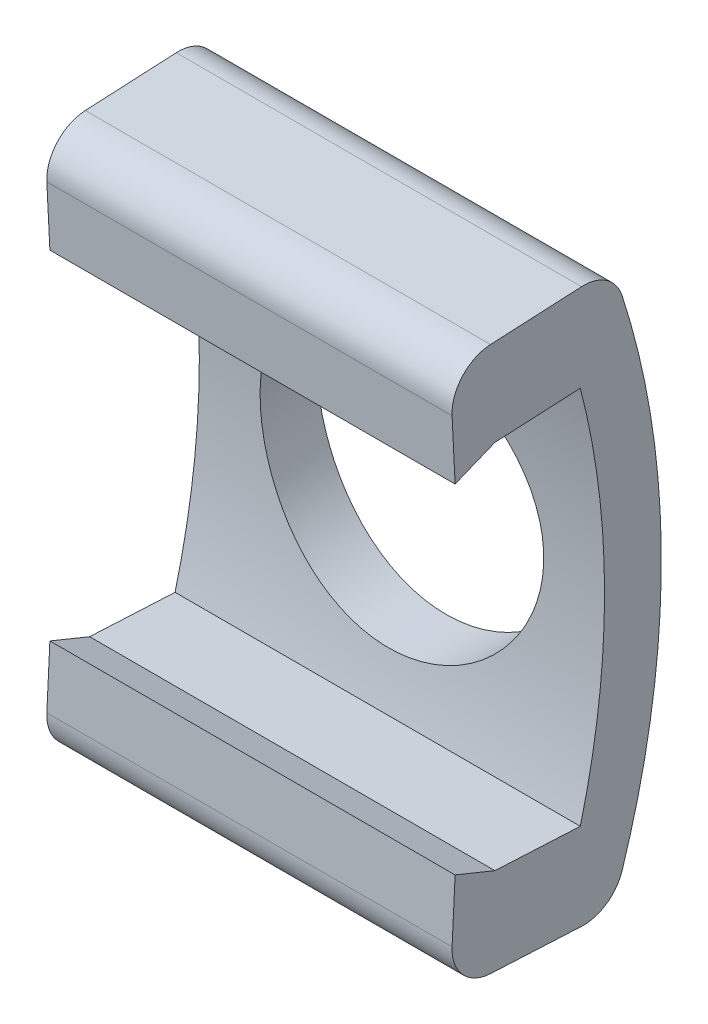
SolidWorks part; units mm, degrees
ref_plane "正面" through (0, 0, 0) normal (0, 0, 1) x (1, 0, 0)
ref_plane "平面" through (0, 0, 0) normal (0, 1, 0) x (1, 0, 0)
ref_plane "右側面" through (0, 0, 0) normal (1, 0, 0) x (0, 0, -1)
sketch "ｽｹｯﾁ1" plane through (0, 0, 0) normal (1, 0, 0) x (0, 0, -1)
  line L18 (-5.0877, -4.1759) -> (-5.1629, -5.674)
  line L19 (-4.1065, -4.5756) -> (-5.0877, -4.1759)
  line L20 (-1.9987, -4.6813) -> (-4.1065, -4.5756)
  line L21 (-1.9688, -6.8355) -> (-4.2142, -6.7229)
  line L22 (-1.9688, 6.8355) -> (-4.2142, 6.7229)
  line L23 (-5.0877, 4.1759) -> (-5.1629, 5.674)
  line L24 (-4.1065, 4.5756) -> (-5.0877, 4.1759)
  line L25 (-1.9987, 4.6813) -> (-4.1065, 4.5756)
  arc A10 (0, 0) -> (-0.9671, 6.1439) centre (-20, 0) ccw
  arc A11 (-0.9671, -6.1439) -> (0, 0) centre (-20, 0) ccw
  arc A12 (-1.4, 0) -> (-1.9987, 4.6813) centre (-20, 0) ccw
  arc A13 (-1.9987, -4.6813) -> (-1.4, 0) centre (-20, 0) ccw
  arc A14 (-1.9688, -6.8355) -> (-0.9671, -6.1439) centre (-1.9187, -5.8367) ccw
  arc A15 (-5.1629, -5.674) -> (-4.2142, -6.7229) centre (-4.1641, -5.7241) ccw
  arc A16 (-0.9671, 6.1439) -> (-1.9688, 6.8355) centre (-1.9187, 5.8367) ccw
  arc A17 (-4.2142, 6.7229) -> (-5.1629, 5.674) centre (-4.1641, 5.7241) ccw
extrude "押し出し1" add sketch "ｽｹｯﾁ1" along normal mid plane 10
sketch "ｽｹｯﾁ2" plane through (0, 0, 0) normal (0, 0, 1) x (1, 0, 0)
  circle A0 centre (0, 0) radius 3.5
extrude "ｶｯﾄ - 押し出し1" cut sketch "ｽｹｯﾁ2" along normal through all
